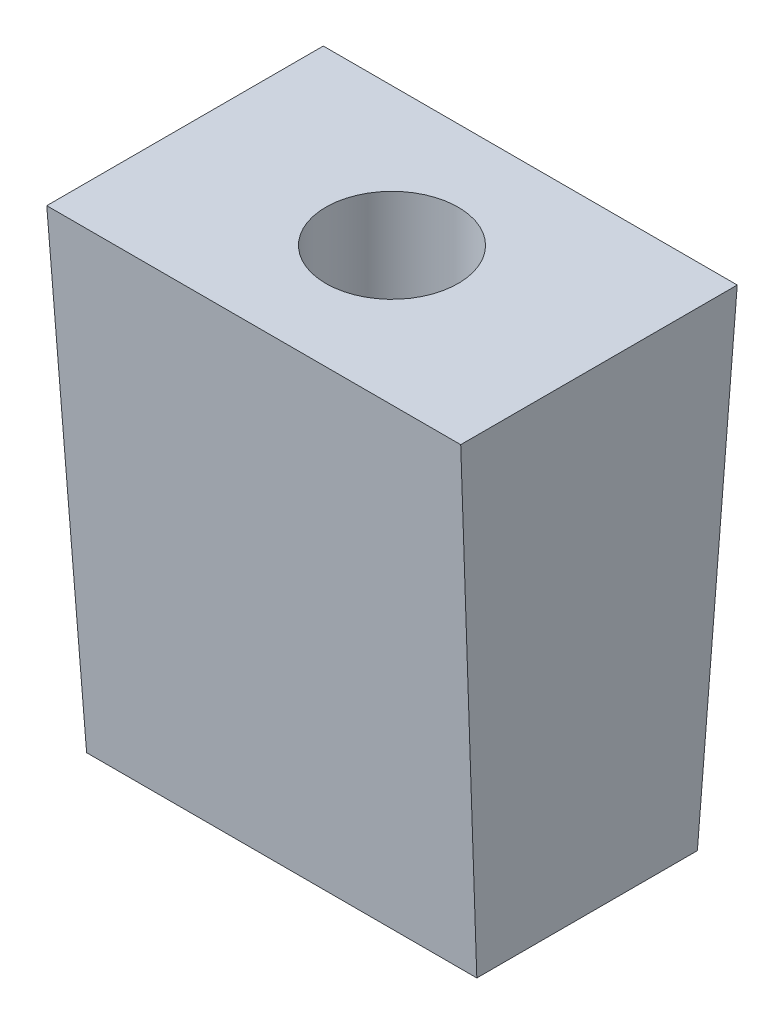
SolidWorks part; units mm, degrees
ref_plane "Plan de face" through (0, 0, 0) normal (0, 0, 1) x (1, 0, 0)
ref_plane "Plan de dessus" through (0, 0, 0) normal (0, 1, 0) x (1, 0, 0)
ref_plane "Plan de droite" through (0, 0, 0) normal (1, 0, 0) x (0, 0, -1)
sketch "Esquisse1" plane through (0, 0, 0) normal (0, 0, 1) x (1, 0, 0)
  line L0 (0, 0) -> (0, 14.2) construction
  line L1 (-5.75, 0) -> (5.75, 0)
  line L2 (-5.75, 0) -> (-6.1, 14.2)
  line L3 (-6.1, 14.2) -> (6.1, 14.2)
  line L4 (5.75, 0) -> (6.1, 14.2)
  dimension "D1" = 11.5
  dimension "D2" = 12.2
  dimension "D3" = 14.2
extrude "Extrusion1" add sketch "Esquisse1" against normal blind 8.15
sketch "Esquisse2" plane through (0, 0, 0) normal (1, 0, 0) x (0, 0, -1)
  line L0 (0, 14.2) -> (0.825, 0)
  line L1 (8.15, 0) -> (0, 0) construction
  line L2 (0.825, 0) -> (4.075, 0)
  line L3 (4.075, 0) -> (7.325, 0)
  line L4 (7.325, 0) -> (8.15, 14.2)
  line L5 (8.15, 14.2) -> (0, 14.2) construction
  line L6 (8.15, 0) -> (8.15, 14.2) construction
  dimension "D1" = 6.5
extrude "Enlèv. mat.-Extru.1" cut sketch "Esquisse2" against normal through all and the other way through all flip side to cut
sketch "Esquisse3" plane through (0, 0, 0) normal (0, -1, 0) x (1, 0, 0)
  line L0 (0, -4.075) -> (5.75, -4.075) construction
  line L1 (5.75, -7.325) -> (5.75, -0.825) construction
  circle A0 centre (0, -4.075) radius 2.45
  dimension "D1" = 4.9
extrude "Enlèv. mat.-Extru.2" cut sketch "Esquisse3" against normal blind 9.2
sketch "Esquisse4" plane through (0, 9.2, 0) normal (0, -1, 0) x (1, 0, 0)
  circle A0 centre (0, -4.075) radius 1.25
  circle A1 centre (0, -4.075) radius 2.45 construction
  dimension "D1" = 2.5
extrude "Enlèv. mat.-Extru.3" cut sketch "Esquisse4" against normal blind 8.15
sketch "Esquisse5" plane through (0, 14.2, 0) normal (0, 1, 0) x (-1, 0, 0)
  circle A0 centre (0, -4.075) radius 1.95
  circle A1 centre (0, -4.075) radius 1.25 construction
  dimension "D1" = 3.9
extrude "Enlèv. mat.-Extru.4" cut sketch "Esquisse5" against normal blind 2.9
